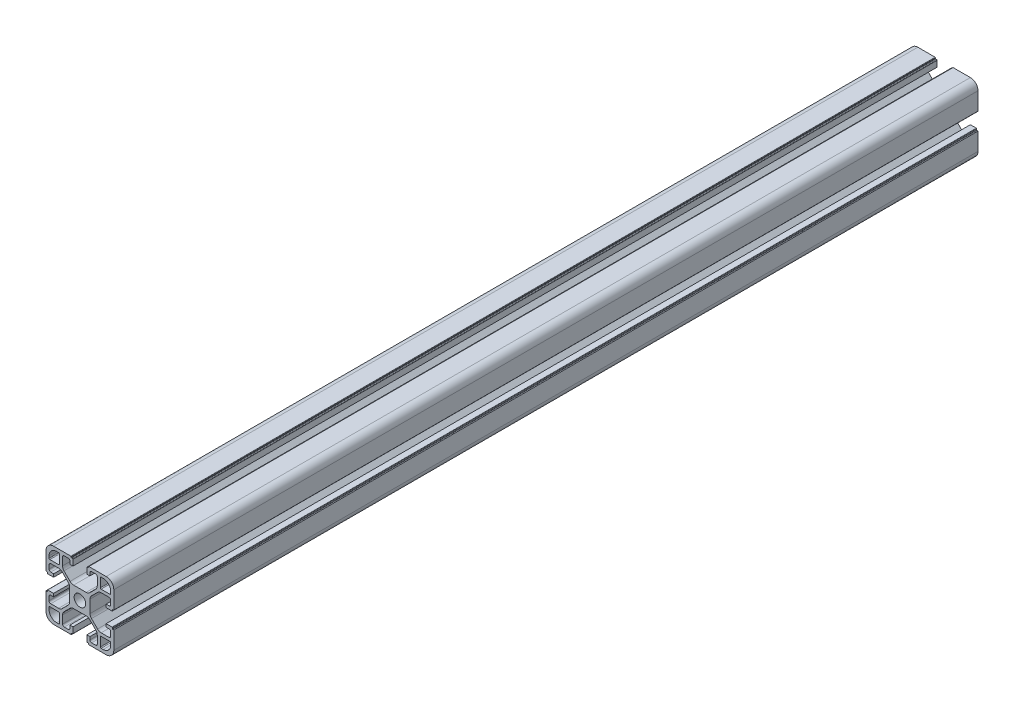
SolidWorks part; units mm, degrees
ref_plane "Front Plane" through (0, 0, 0) normal (0, 0, 1) x (1, 0, 0)
ref_plane "Top Plane" through (0, 0, 0) normal (0, 1, 0) x (1, 0, 0)
ref_plane "Right Plane" through (0, 0, 0) normal (1, 0, 0) x (0, 0, -1)
sketch "Sketch1" plane through (0, 0, 0) normal (0, 0, 1) x (1, 0, 0)
  line L6 (-20, 20) -> (20, 20)
  line L10 (-20, 20) -> (-20, -20)
  line L11 (-20, -20) -> (20, -20)
  line L12 (20, 20) -> (20, -20)
  line L13 (-20, 20) -> (20, -20) construction
  line L14 (-20, -20) -> (20, 20) construction
  point P0 (0, 0)
  dimension "D1" = 40
extrude "Boss-Extrude1" add sketch "Sketch1" along normal blind 510
sketch "Sketch2" plane through (0, 0, 0) normal (0, 0, -1) x (-1, 0, 0)
  circle A0 centre (0, 0) radius 3.4
  dimension "D1" = 6.8
extrude "Cut-Extrude1" cut sketch "Sketch2" against normal through all
sketch "Sketch3" plane through (0, 0, 0) normal (0, 0, -1) x (-1, 0, 0)
  line L0 (-20, 20) -> (0, 0) construction
  line L1 (0, 0) -> (20, 20) construction
  line L3 (10.25, 18.2) -> (10.25, 11.3107)
  line L4 (10.25, 11.3107) -> (4.9393, 6)
  line L5 (4.9393, 6) -> (-4.9393, 6)
  line L6 (-4.9393, 6) -> (-10.25, 11.3107)
  line L7 (-10.25, 11.3107) -> (-10.25, 18.2)
  line L8 (-10.25, 18.2) -> (-5.9, 18.2)
  line L9 (-5.9, 18.2) -> (-5.9, 15.5)
  line L11 (5.9, 15.5) -> (5.9, 18.2)
  line L12 (5.9, 18.2) -> (10.25, 18.2)
  line L13 (-5.9, 15.5) -> (-4.1, 15.5)
  line L14 (-4.1, 15.5) -> (-4.1, 20)
  line L15 (-20, 20) -> (20, 20) construction
  line L16 (5.9, 15.5) -> (4.1, 15.5)
  line L17 (4.1, 15.5) -> (4.1, 20)
  line L18 (4.1, 20) -> (-4.1, 20)
  line L19 (0, 0) -> (0, 6) construction
  point P15 (0, 20)
  point P31 (0, 6)
  dimension "D1" = 1.8
  dimension "D2" = 20.5
  dimension "D3" = 1.8
  dimension "D4" = 8.2
  dimension "D5" = 4.5
  dimension "D6" = 6
  dimension "D7" = 0.75
extrude "Cut-Extrude2" cut sketch "Sketch3" against normal through all
fillet "Fillet1" radius 1 4 edges at (5.9, 18.2, 255) (-10.25, 18.2, 255) (-5.9, 18.2, 255) (10.25, 18.2, 255)
sketch "Sketch4" plane through (0, 0, 0) normal (0, 0, -1) x (-1, 0, 0)
  line L1 (-5.1, 20) -> (5.1, 20)
  line L2 (-5.1, 20) -> (-5.1, 19.2)
  line L3 (-5.1, 19.2) -> (5.1, 19.2)
  line L4 (5.1, 20) -> (5.1, 19.2)
  line L5 (-20, 20) -> (-4.1, 20) construction
  line L6 (0, 20) -> (0, 19.2) construction
  line L7 (4.1, 15.5) -> (4.1, 20) construction
  line L8 (-4.1, 20) -> (-4.1, 15.5) construction
  dimension "D1" = 0.8
  dimension "D2" = 10.2
extrude "Cut-Extrude3" cut sketch "Sketch4" against normal through all and the other way through all
fillet "Fillet3" radius 0.2 6 edges at (-4.1, 19.2, 255) (4.1, 19.2, 255) (5.1, 20, 255) (5.1, 19.2, 255) (-5.1, 20, 255) (-5.1, 19.2, 255)
pattern_circular "CirPattern1" count 4 over 360 about axis through (0, 0, 0) along (0, 0, 1) of "Cut-Extrude2", "Fillet1", "Fillet3", "Cut-Extrude3"
fillet "Fillet4" radius 4.5 4 edges at (-20, -20, 255) (20, -20, 255) (-20, 20, 255) (20, 20, 255)
sketch "Sketch6" plane through (0, 0, 0) normal (0, 0, -1) x (-1, 0, 0)
  line L0 (-10.25, 17.2) -> (-10.25, 11.3107) construction
  line L1 (-12.05, 12.05) -> (-18.2, 12.05)
  line L2 (-12.05, 12.05) -> (-12.05, 18.2)
  line L3 (-12.05, 18.2) -> (-13.7, 18.2)
  line L4 (-18.2, 12.05) -> (-18.2, 13.7)
  line L5 (-11.3107, 10.25) -> (-17.2, 10.25) construction
  line L6 (-20, 5.1) -> (-20, 15.5) construction
  arc A0 (-18.2, 13.7) -> (-13.7, 18.2) centre (-13.7, 13.7) cw
  dimension "D4" = 4.5
  dimension "D1" = 1.8
  dimension "D2" = 1.8
  dimension "D3" = 1.8
extrude "Cut-Extrude4" cut sketch "Sketch6" against normal through all
fillet "Fillet6" radius 0.5 3 edges at (18.2, 12.05, 255) (12.05, 18.2, 255) (12.05, 12.05, 255)
pattern_circular "CirPattern2" count 4 over 360 about axis through (0, 0, 0) along (0, 0, 1) of "Cut-Extrude4", "Fillet6"
fillet "Fillet5" radius 3 16 edges at (4.9393, 6, 255) (6, 4.9393, 255) (11.3107, 10.25, 255) (10.25, 11.3107, 255) (11.3107, -10.25, 255) (6, -4.9393, 255) (10.25, -11.3107, 255) (4.9393, -6, 255) (-10.25, -11.3107, 255) (-4.9393, -6, 255) (-11.3107, -10.25, 255) (-6, -4.9393, 255) (-6, 4.9393, 255) (-11.3107, 10.25, 255) (-10.25, 11.3107, 255) (-4.9393, 6, 255)
